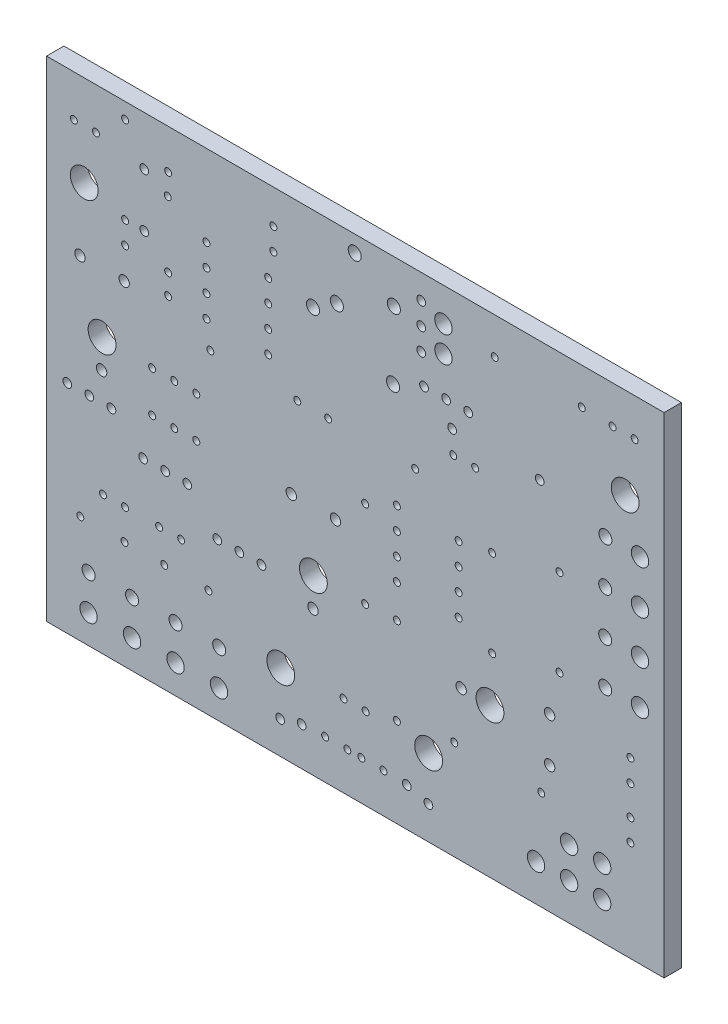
SolidWorks part; units mm, degrees
ref_plane "Face" through (0, 0, 0) normal (0, 0, 1) x (1, 0, 0)
ref_plane "Dessus" through (0, 0, 0) normal (0, 1, 0) x (1, 0, 0)
ref_plane "Droite" through (0, 0, 0) normal (1, 0, 0) x (0, 0, -1)
sketch "Esquisse1" plane through (0, 0, 0) normal (0, 0, 1) x (1, 0, 0)
  line L1 (0, 0) -> (71, 0)
  line L2 (0, 0) -> (0, -56.3)
  line L3 (0, -56.3) -> (71, -56.3)
  line L4 (71, 0) -> (71, -56.3)
  dimension "D1" = 71
  dimension "D2" = 56.3
extrude "Extrusion1" add sketch "Esquisse1" along normal blind 2
sketch "Esquisse3" plane through (0, 0, 0) normal (0, 0, -1) x (-1, 0, 0)
  circle A0 centre (-46.6324, -13.7998) radius 0.5004
  circle A1 centre (-56.6959, -13.8506) radius 0.5004
  circle A2 centre (-26.0813, -3.9014) radius 0.3988
  circle A3 centre (-26.0813, -6.4414) radius 0.3988
  circle A4 centre (-65.0805, -4.3332) radius 0.3988
  circle A5 centre (-67.6205, -4.3332) radius 0.3988
  circle A6 centre (-5.6826, -4.7701) radius 0.3988
  circle A7 centre (-3.1426, -4.7701) radius 0.3988
  circle A8 centre (-4.3313, -10.4521) radius 1.6002
  circle A9 centre (-25.4819, -9.3497) radius 0.3988
  circle A10 centre (-40.2824, -46.0502) radius 0.3988
  circle A11 centre (-40.2824, -36.0502) radius 0.3988
  circle A12 centre (-36.6325, -26.2509) radius 0.3988
  circle A13 centre (-36.6325, -36.2509) radius 0.3988
  circle A14 centre (-61.5321, -4.2012) radius 0.3988
  circle A15 centre (-51.5321, -4.2012) radius 0.3988
  circle A16 centre (-46.8814, -44.9021) radius 0.3988
  circle A17 centre (-56.8813, -44.9021) radius 0.3988
  circle A18 centre (-28.8321, -19.9009) radius 0.3988
  circle A19 centre (-18.8321, -19.9009) radius 0.3988
  circle A20 centre (-58.9819, -31.8999) radius 0.3988
  circle A21 centre (-58.9819, -21.8999) radius 0.3988
  circle A22 centre (-51.2324, -23.8506) radius 0.3988
  circle A23 centre (-51.2324, -33.8506) radius 0.3988
  circle A24 centre (-32.383, -19.9009) radius 0.3988
  circle A25 centre (-42.383, -19.9009) radius 0.3988
  circle A26 centre (-43.9324, -47.4497) radius 1.6002
  circle A27 centre (-13.9833, -4.5517) radius 0.3988
  circle A28 centre (-13.9833, -14.5517) radius 0.3988
  circle A29 centre (-36.6833, -46.9011) radius 0.3988
  circle A30 centre (-34.1433, -46.9011) radius 0.3988
  circle A31 centre (-38.7356, -51.7677) radius 0.3988
  circle A32 centre (-66.5333, -10.4521) radius 1.6002
  circle A33 centre (-11.2325, -11.8008) radius 0.5004
  circle A34 centre (-57.8415, -36.6116) radius 0.5994
  circle A35 centre (-57.8415, -41.6916) radius 0.5994
  circle A36 centre (-47.6713, -39.1008) radius 0.5994
  circle A37 centre (-3.8436, -17.94) radius 0.5994
  circle A38 centre (-8.9236, -17.94) radius 0.5994
  circle A39 centre (-6.3328, -28.1102) radius 0.5994
  circle A40 centre (-19.6322, -38.3007) radius 0.5004
  circle A41 centre (-22.1722, -38.3007) radius 0.5004
  circle A42 centre (-24.7122, -38.3007) radius 0.5004
  circle A43 centre (-11.2325, -5.6515) radius 0.5004
  circle A44 centre (-50.9835, -39.1516) radius 1.6002
  circle A45 centre (-6.3836, -24.8006) radius 1.6002
  circle A46 centre (-64.255, -15.7404) radius 0.7493
  circle A47 centre (-64.2321, -20.7518) radius 0.7493
  circle A48 centre (-64.2321, -30.7518) radius 0.7493
  circle A49 centre (-64.2321, -25.7505) radius 0.7493
  circle A50 centre (-26.9322, -47.4497) radius 1.6002
  circle A51 centre (-68.2326, -15.7505) radius 1.0008
  circle A52 centre (-68.2326, -25.7505) radius 1.0008
  circle A53 centre (-68.2326, -20.7518) radius 1.0008
  circle A54 centre (-68.2326, -30.7518) radius 1.0008
  circle A55 centre (-60.0817, -48.4505) radius 1.0008
  circle A56 centre (-63.8816, -48.4505) radius 1.0008
  circle A57 centre (-32.0325, -51.75) radius 0.3988
  circle A58 centre (-34.5827, -51.7576) radius 0.3988
  circle A59 centre (-36.1956, -51.7677) radius 0.3988
  circle A60 centre (-13.9833, -16.9012) radius 0.3988
  circle A61 centre (-13.9325, -7.0002) radius 0.3988
  circle A62 centre (-6.4827, -40.4012) radius 0.3988
  circle A63 centre (-9.0227, -40.4012) radius 0.3988
  circle A64 centre (-19.8532, -48.9509) radius 0.7493
  circle A65 centre (-12.1418, -25.0012) radius 0.3988
  circle A66 centre (-14.6818, -25.0012) radius 0.3988
  circle A67 centre (-17.2218, -25.0012) radius 0.3988
  circle A68 centre (-16.1829, -34.5008) radius 0.5004
  circle A69 centre (-13.6429, -34.5008) radius 0.5004
  circle A70 centre (-11.1029, -34.5008) radius 0.5004
  circle A71 centre (-14.8316, -49.0017) radius 0.7493
  circle A72 centre (-4.8317, -49.0017) radius 0.7493
  circle A73 centre (-9.8329, -49.0017) radius 0.7493
  circle A74 centre (-19.8329, -53.0022) radius 1.0008
  circle A75 centre (-9.8329, -53.0022) radius 1.0008
  circle A76 centre (-14.8316, -53.0022) radius 1.0008
  circle A77 centre (-4.8317, -53.0022) radius 1.0008
  circle A78 centre (-15.4819, -40.4012) radius 0.3988
  circle A79 centre (-12.9419, -40.4012) radius 0.3988
  circle A80 centre (-3.8817, -43.9014) radius 0.3988
  circle A81 centre (-8.9617, -43.9014) radius 0.3988
  circle A82 centre (-13.5337, -43.9014) radius 0.3988
  circle A83 centre (-18.6137, -43.9014) radius 0.3988
  circle A84 centre (-67.1328, -36.3017) radius 0.3988
  circle A85 centre (-67.1328, -38.8417) radius 0.3988
  circle A86 centre (-67.1328, -44.7497) radius 0.3988
  circle A87 centre (-67.1328, -42.2504) radius 0.3988
  circle A88 centre (-26.8636, -52.5577) radius 0.5004
  circle A89 centre (-29.335, -51.8693) radius 0.5004
  circle A90 centre (-41.4229, -51.8693) radius 0.5004
  circle A91 centre (-43.907, -52.5094) radius 0.5004
  circle A92 centre (-63.8816, -52.0497) radius 1.0008
  circle A93 centre (-60.0817, -52.0497) radius 1.0008
  circle A94 centre (-56.2819, -52.0497) radius 1.0008
  circle A95 centre (-35.4336, -1.8999) radius 0.7493
  circle A96 centre (-39.9319, -4.9505) radius 0.7493
  circle A97 centre (-39.8329, -12.7508) radius 0.7493
  circle A98 centre (-30.633, -9.7003) radius 0.7493
  circle A99 centre (-33.3813, -7.9502) radius 0.7493
  circle A100 centre (-9.0328, -11.8008) radius 0.3988
  circle A101 centre (-9.0328, -1.8009) radius 0.3988
  circle A102 centre (-9.0328, -14.3408) radius 0.3988
  circle A103 centre (-17.2218, -29.7002) radius 0.3988
  circle A104 centre (-14.6818, -29.7002) radius 0.3988
  circle A105 centre (-12.1418, -29.7002) radius 0.3988
  circle A106 centre (-2.3831, -31.3512) radius 0.5004
  circle A107 centre (-4.9231, -31.3512) radius 0.5004
  circle A108 centre (-7.4631, -31.3512) radius 0.5004
  circle A109 centre (-28.1412, -29.5402) radius 0.5994
  circle A110 centre (-33.2212, -29.5402) radius 0.5994
  circle A111 centre (-30.633, -39.7104) radius 0.5994
  circle A112 centre (-30.6812, -36.4007) radius 1.6002
  circle A113 centre (-47.3817, -24.5999) radius 0.3988
  circle A114 centre (-47.3817, -32.2199) radius 0.3988
  circle A115 centre (-47.3817, -27.1399) radius 0.3988
  circle A116 centre (-47.3817, -29.6799) radius 0.3988
  circle A117 centre (-40.2824, -24.5999) radius 0.3988
  circle A118 centre (-40.2824, -32.2199) radius 0.3988
  circle A119 centre (-40.2824, -27.1399) radius 0.3988
  circle A120 centre (-40.2824, -29.6799) radius 0.3988
  circle A121 centre (-25.4819, -16.9697) radius 0.3988
  circle A122 centre (-25.4819, -11.8897) radius 0.3988
  circle A123 centre (-25.4819, -14.4297) radius 0.3988
  circle A124 centre (-18.3826, -9.3497) radius 0.3988
  circle A125 centre (-18.3826, -16.9697) radius 0.3988
  circle A126 centre (-18.3826, -11.8897) radius 0.3988
  circle A127 centre (-18.3826, -14.4297) radius 0.3988
  circle A128 centre (-48.4816, -11.2014) radius 0.5004
  circle A129 centre (-43.4016, -11.2014) radius 0.5004
  circle A130 centre (-45.9416, -11.2014) radius 0.5004
  circle A131 centre (-43.0815, -7.9019) radius 0.5004
  circle A132 centre (-43.0815, -2.8219) radius 0.5004
  circle A133 centre (-43.0815, -5.3619) radius 0.5004
  circle A134 centre (-45.6317, -6.8504) radius 1.0008
  circle A135 centre (-49.2817, -16.35) radius 0.3988
  circle A136 centre (-46.762, -16.35) radius 0.3988
  circle A137 centre (-45.6317, -3.8506) radius 1.0008
extrude "Enlèv. mat.-Extru.2" cut sketch "Esquisse3" against normal through all
